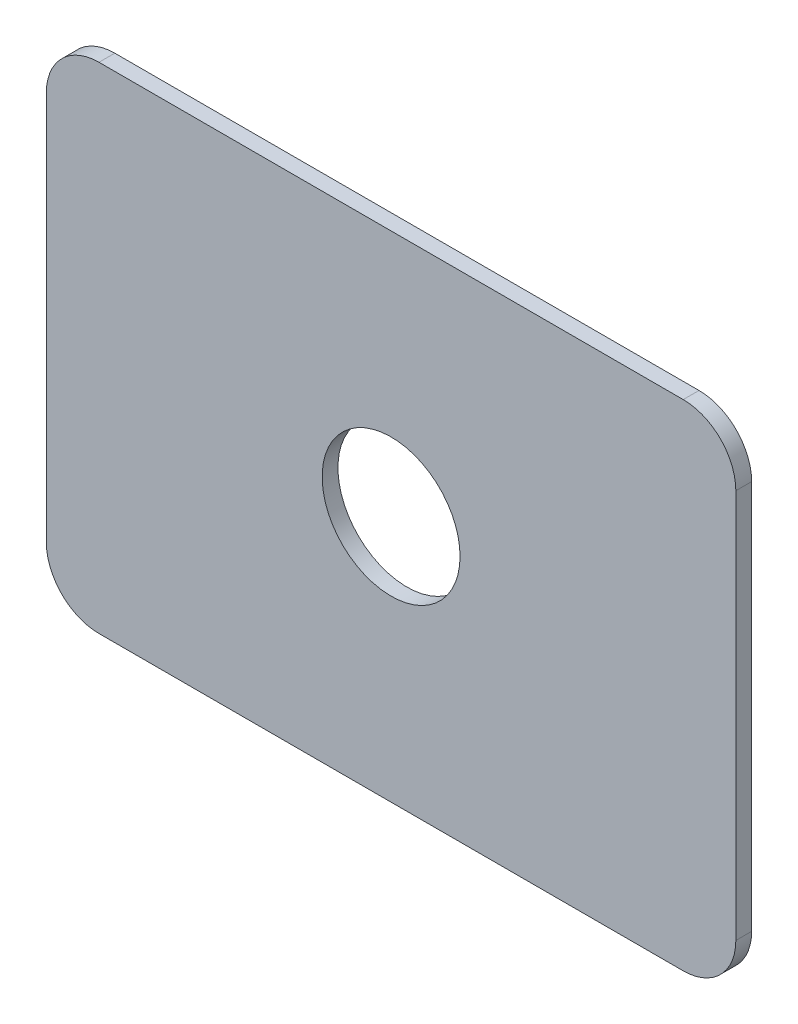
SolidWorks part; units mm, degrees
ref_plane "Plan de face" through (0, 0, 0) normal (0, 0, 1) x (1, 0, 0)
ref_plane "Plan de dessus" through (0, 0, 0) normal (0, 1, 0) x (1, 0, 0)
ref_plane "Plan de droite" through (0, 0, 0) normal (1, 0, 0) x (0, 0, -1)
sketch "Esquisse1" plane through (0, 0, 0) normal (0, 0, 1) x (1, 0, 0)
  line L1 (-111, 94) -> (111, 94)
  line L2 (-131, 74) -> (-131, -74)
  line L3 (-111, -94) -> (111, -94)
  line L4 (131, 74) -> (131, -74)
  arc A0 (-111, 94) -> (-131, 74) centre (-111, 74) ccw
  arc A1 (111, 94) -> (131, 74) centre (111, 74) cw
  arc A2 (111, -94) -> (131, -74) centre (111, -74) ccw
  arc A3 (-131, -74) -> (-111, -94) centre (-111, -74) ccw
  point P6 (-131, 94)
  point P9 (131, 94)
  point P14 (-131, -94)
  dimension "D5" = 20
  dimension "D1" = 262
  dimension "D2" = 188
  dimension "D3" = 94
  dimension "D4" = 131
extrude "Extrusion1" add sketch "Esquisse1" along normal blind 6
sketch "Esquisse2" plane through (0, 0, 6) normal (0, 0, 1) x (1, 0, 0)
  circle A0 centre (0, 0) radius 26.2
  dimension "D1" = 52.4
extrude "Enlèv. mat.-Extru.1" cut sketch "Esquisse2" against normal blind 10
